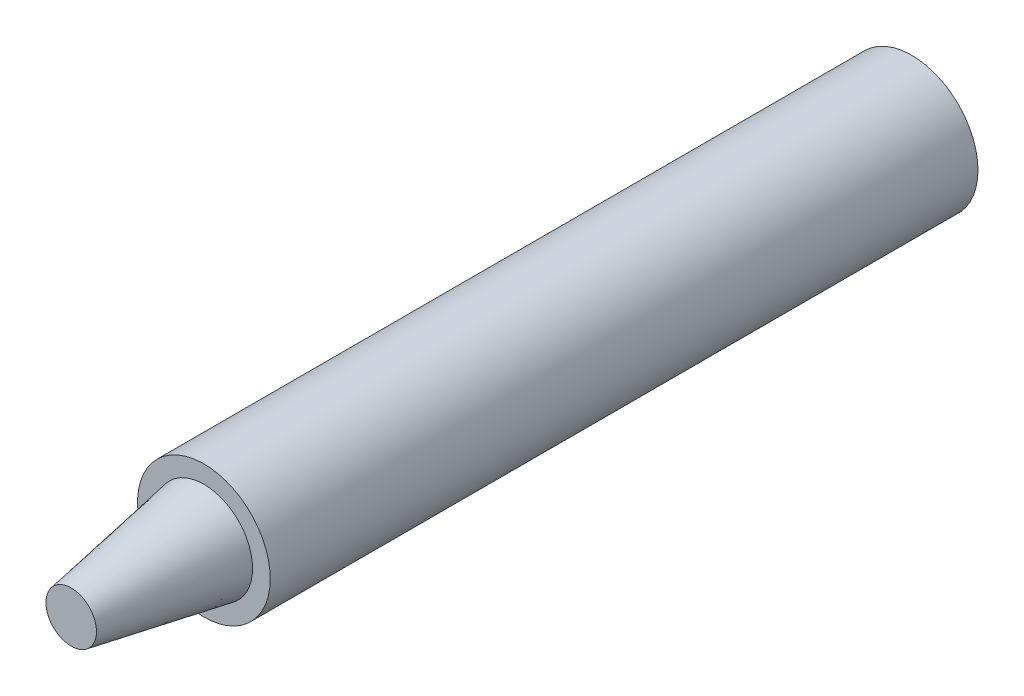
SolidWorks part; units mm, degrees
ref_plane "Plane1" through (0, 0, 0) normal (0, 0, 1) x (1, 0, 0)
ref_plane "Plane2" through (0, 0, 0) normal (0, 1, 0) x (1, 0, 0)
ref_plane "Plane3" through (0, 0, 0) normal (1, 0, 0) x (0, 0, -1)
sketch "Sketch1" plane through (0, 0, 0) normal (0, 0, 1) x (1, 0, 0)
  circle A0 centre (0, 0) radius 9.525
  dimension "D1" = 19.05
extrude "Base-Extrude" add sketch "Sketch1" along normal blind 101.6
sketch "Sketch2" plane through (0, 0, 101.6) normal (0, 0, 1) x (1, 0, 0)
  circle A3 centre (0, 0) radius 6.985
  circle A4 centre (0, 0) radius 6.985
  dimension "D2" = 2.54
extrude "Boss-Extrude1" add sketch "Sketch2" along normal blind 19.05 draft 10
